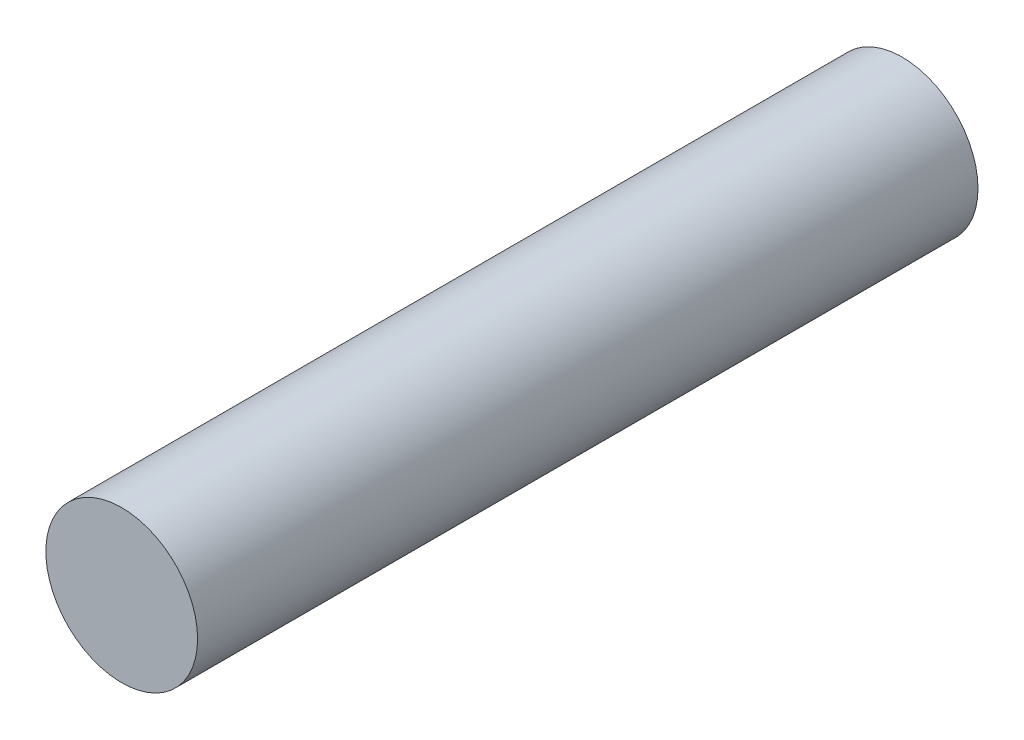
SolidWorks part; units mm, degrees
ref_plane "Front Plane" through (0, 0, 0) normal (0, 0, 1) x (1, 0, 0)
ref_plane "Top Plane" through (0, 0, 0) normal (0, 1, 0) x (1, 0, 0)
ref_plane "Right Plane" through (0, 0, 0) normal (1, 0, 0) x (0, 0, -1)
sketch "Sketch1" plane through (0, 0, 0) normal (0, 1, 0) x (1, 0, 0)
  line L0 (0, 0) -> (1.585, 0)
  line L1 (1.585, 0) -> (1.585, 16.3049)
  line L2 (0, 0) -> (0, 16.5608) construction
  line L3 (0, 16.5608) -> (0.381, 16.5608)
  line L4 (0.381, 16.5608) -> (1.585, 16.3049)
  line L5 (0, 0) -> (0, 24.9197) construction
  line L6 (0, 16.5608) -> (0, 0)
  dimension "D1" = 1.585
  dimension "D2" = 16.5608
  dimension "D3" = 0.381
  dimension "D4" = 12
revolve "Revolve1" add sketch "Sketch1" angle 360 about L5
